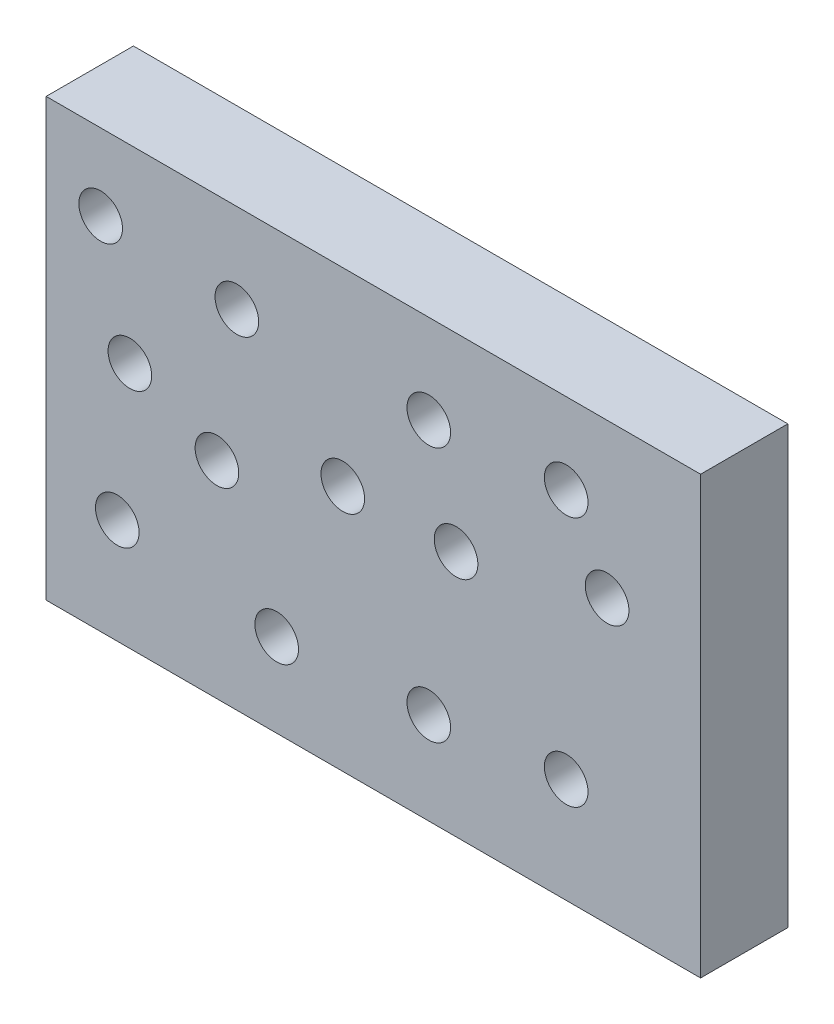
SolidWorks part; units mm, degrees
ref_plane "Płaszczyzna przednia" through (0, 0, 0) normal (0, 0, 1) x (1, 0, 0)
ref_plane "Płaszczyzna górna" through (0, 0, 0) normal (0, 1, 0) x (1, 0, 0)
ref_plane "Płaszczyzna prawa" through (0, 0, 0) normal (1, 0, 0) x (0, 0, -1)
sketch "Szkic1" plane through (0, 0, 0) normal (0, 0, 1) x (1, 0, 0)
  line L1 (0, 0) -> (300, 0)
  line L2 (0, 0) -> (0, 200)
  line L3 (0, 200) -> (300, 200)
  line L4 (300, 0) -> (300, 200)
  dimension "D1" = 200
  dimension "D2" = 300
extrude "Dodanie-wyciągnięcie1" add sketch "Szkic1" along normal blind 40
hole_wizard "Otwory ustalające Ø20.0mm1" positions "Szkic2" profile "Szkic3" hole size "Ø20.0" standard "ISO"
sketch "Szkic2" plane through (0, 0, 40) normal (0, 0, 1) x (1, 0, 0)
  line L0 (300, 200) -> (0, 200) construction
  line L1 (0, 200) -> (0, 0) construction
  point P0 (25, 165)
  point P2 (38.378, 113.2057)
  point P4 (87.4192, 159.2031)
  point P6 (78.2841, 94.6313)
  point P8 (32.6085, 48.0894)
  point P10 (105.6894, 38.3218)
  point P12 (135.9796, 113.2057)
  point P14 (187.9055, 113.2057)
  point P16 (175.4049, 159.2031)
  point P18 (175.4049, 42.1747)
  point P20 (238.3891, 48.0894)
  point P22 (257.1402, 129.4074)
  point P24 (238.3891, 162.959)
  dimension "D1" = 35
  dimension "D2" = 25
sketch "Szkic3" plane through (25, 165, 40) normal (1, 0, 0) x (0, -1, 0)
  line L0 (0, 0) -> (0, 40)
  line L1 (0, 40) -> (10, 40)
  line L2 (10, 40) -> (10, 0)
  line L5 (10, 0) -> (0, 0)
  line L11 (0, -6.35) -> (0, 107.95) construction
  dimension "Średnica otworu na wylot" = 20
  dimension "Głębokość otworu na wylot" = 40
